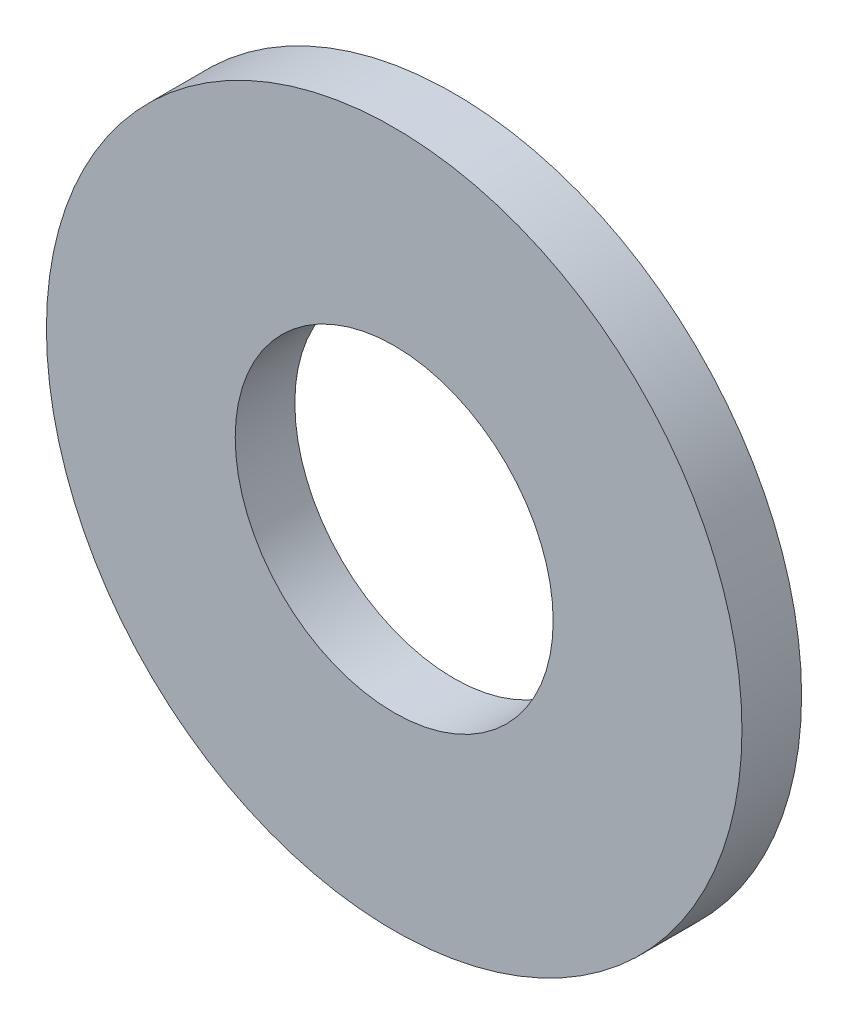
SolidWorks part; units mm, degrees
ref_plane "Plan1" through (0, 0, 0) normal (0, 0, 1) x (1, 0, 0)
ref_plane "Plan2" through (0, 0, 0) normal (0, 1, 0) x (1, 0, 0)
ref_plane "Plan3" through (0, 0, 0) normal (1, 0, 0) x (0, 0, -1)
extrude "Corps" add sketch "E_corps" along normal blind 1.2
sketch "E_corps" plane through (0, 0, 0) normal (0, 0, 1) x (1, 0, 0)
  circle A0 centre (0, 0) radius 7
  dimension "Diam_base" = 14
extrude "Diamètre_nominal" cut sketch "E_perçage" against normal through all
sketch "E_perçage" plane through (0, 0, 0) normal (0, 0, -1) x (-1, 0, 0)
  circle A0 centre (0, 0) radius 3.2
  dimension "Diamètre_nominal" = 6.4
